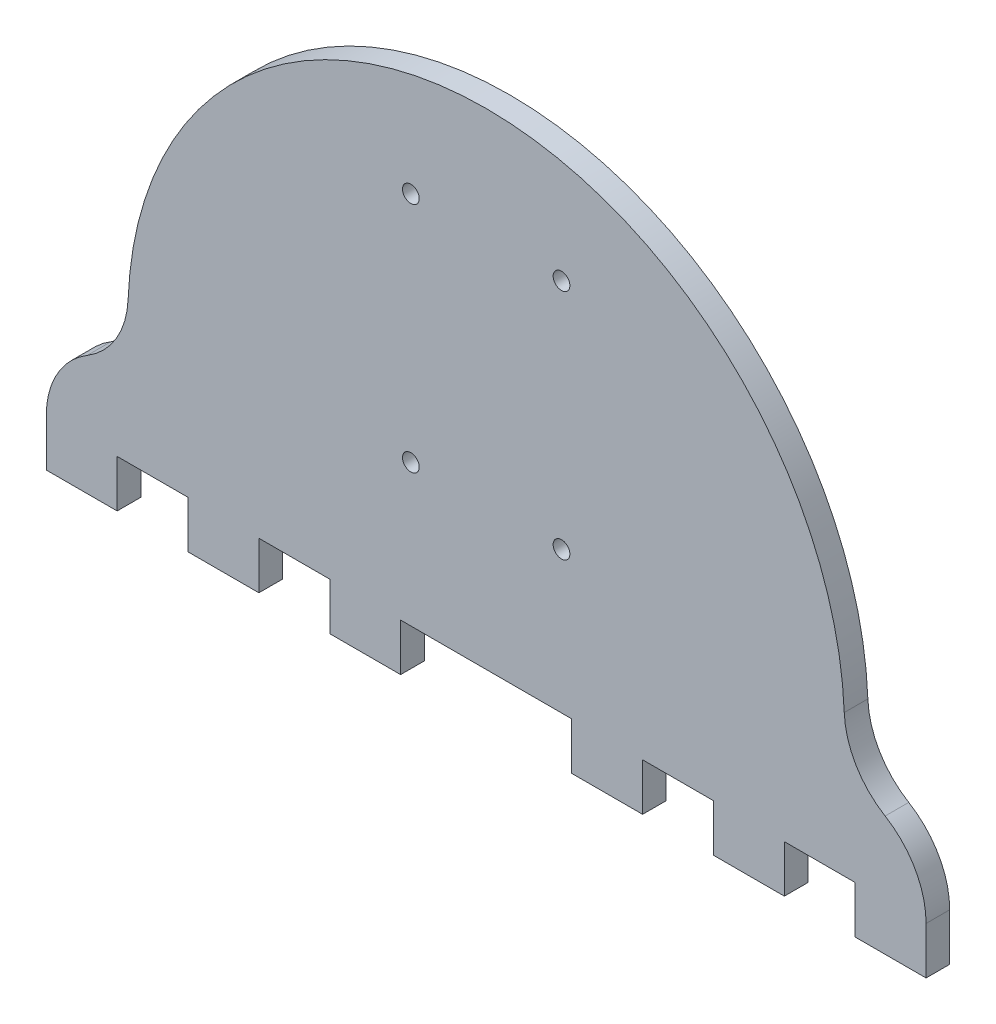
SolidWorks part; units mm, degrees
ref_plane "Front Plane" through (0, 0, 0) normal (0, 0, 1) x (1, 0, 0)
ref_plane "Top Plane" through (0, 0, 0) normal (0, 1, 0) x (1, 0, 0)
ref_plane "Right Plane" through (0, 0, 0) normal (1, 0, 0) x (0, 0, -1)
sketch "Sketch1" plane through (0, 0, 0) normal (0, 0, 1) x (1, 0, 0)
  line L0 (0, 50) -> (0, -50) construction
  line L1 (25.3041, 50) -> (-25.3041, 50) construction
  line L2 (0, 50) -> (0, 71.5) construction
  line L3 (-118.25, -59.1) -> (-118.25, -71.8)
  line L4 (-118.25, -71.8) -> (-99.2, -71.8)
  line L5 (-99.2, -71.8) -> (-99.2, -59.1)
  line L6 (-99.2, -59.1) -> (-80.15, -59.1)
  line L7 (-80.15, -59.1) -> (-80.15, -71.8)
  line L8 (-80.15, -71.8) -> (-61.1, -71.8)
  line L9 (-61.1, -71.8) -> (-61.1, -59.1)
  line L10 (-61.1, -59.1) -> (-42.05, -59.1)
  line L11 (-42.05, -59.1) -> (-42.05, -71.8)
  line L12 (-42.05, -71.8) -> (-23, -71.8)
  line L13 (-23, -71.8) -> (-23, -59.1)
  line L14 (-23, -59.1) -> (23, -59.1)
  line L15 (23, -71.8) -> (23, -59.1)
  line L16 (42.05, -71.8) -> (23, -71.8)
  line L17 (42.05, -59.1) -> (42.05, -71.8)
  line L18 (61.1, -59.1) -> (42.05, -59.1)
  line L19 (61.1, -71.8) -> (61.1, -59.1)
  line L20 (80.15, -71.8) -> (61.1, -71.8)
  line L21 (80.15, -59.1) -> (80.15, -71.8)
  line L22 (99.2, -59.1) -> (80.15, -59.1)
  line L23 (99.2, -71.8) -> (99.2, -59.1)
  line L24 (118.25, -71.8) -> (99.2, -71.8)
  line L25 (118.25, -59.1) -> (118.25, -71.8)
  arc A0 (-42.4013, -42.5888) -> (42.4013, -42.5888) centre (0, 75) ccw construction
  arc A1 (0, 71.5) -> (-96.25, -21) centre (0, -24.826) ccw
  arc A2 (0, 71.5) -> (96.25, -21) centre (0, -24.826) cw
  circle A3 centre (-20.25, -21) radius 2.25
  circle A4 centre (20.25, -21) radius 2.25
  circle A5 centre (-20.25, 41.5) radius 2.25
  circle A6 centre (20.25, 41.5) radius 2.25
  circle A7 centre (20.25, 41.5) radius 2.25 construction
  circle A8 centre (-20.25, 41.5) radius 2.25 construction
  circle A9 centre (-20.25, -21) radius 2.25 construction
  circle A10 centre (20.25, -21) radius 2.25 construction
  arc A11 (-96.25, -21) -> (-107.241, -39.5976) centre (-119.0107, -20.0952) cw
  arc A12 (-107.241, -39.5976) -> (-118.25, -59.1) centre (-95.4713, -59.1) ccw
  arc A13 (96.25, -21) -> (107.241, -39.5976) centre (119.0107, -20.0952) ccw
  arc A14 (107.241, -39.5976) -> (118.25, -59.1) centre (95.4713, -59.1) cw
  point P54 (0, -59.1)
  dimension "D1" = 30
  dimension "D2" = 76
  dimension "D3" = 236.5
  dimension "D4" = 38.1
  dimension "D5" = 12.7
  dimension "D6" = 19.05
extrude "Boss-Extrude1" add sketch "Sketch1" along normal blind 6.35
